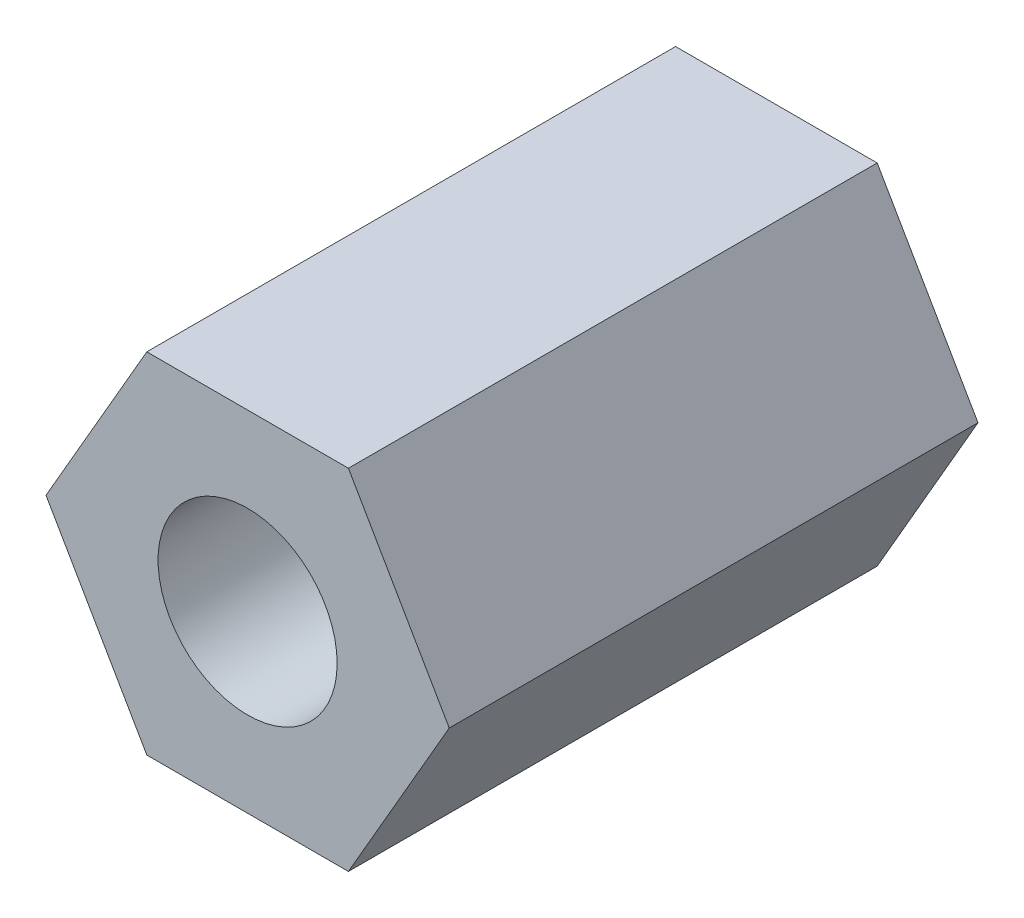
SolidWorks part; units mm, degrees
ref_plane "Front Plane" through (0, 0, 0) normal (0, 0, 1) x (1, 0, 0)
ref_plane "Top Plane" through (0, 0, 0) normal (0, 1, 0) x (1, 0, 0)
ref_plane "Right Plane" through (0, 0, 0) normal (1, 0, 0) x (0, 0, -1)
sketch "Sketch1" plane through (0, 0, 0) normal (0, 0, 1) x (1, 0, 0)
  line L1 (1.1438, 1.9812) -> (-1.1438, 1.9812)
  line L2 (-1.1438, 1.9812) -> (-2.2877, 0)
  line L3 (-2.2877, 0) -> (-1.1438, -1.9812)
  line L4 (-1.1438, -1.9812) -> (1.1438, -1.9812)
  line L5 (1.1438, -1.9812) -> (2.2877, 0)
  line L6 (2.2877, 0) -> (1.1438, 1.9812)
  circle A0 centre (0, 0) radius 1.9812 construction
  dimension "D1" = 3.9624
extrude "Boss-Extrude1" add sketch "Sketch1" along normal mid plane 6
sketch "Sketch5" plane through (0, 0, 3) normal (0, 0, 1) x (1, 0, 0)
  circle A0 centre (0, 0) radius 1.016
  dimension "D1" = 2.032
extrude "Cut-Extrude1" cut sketch "Sketch5" against normal through all both and the other way through all
